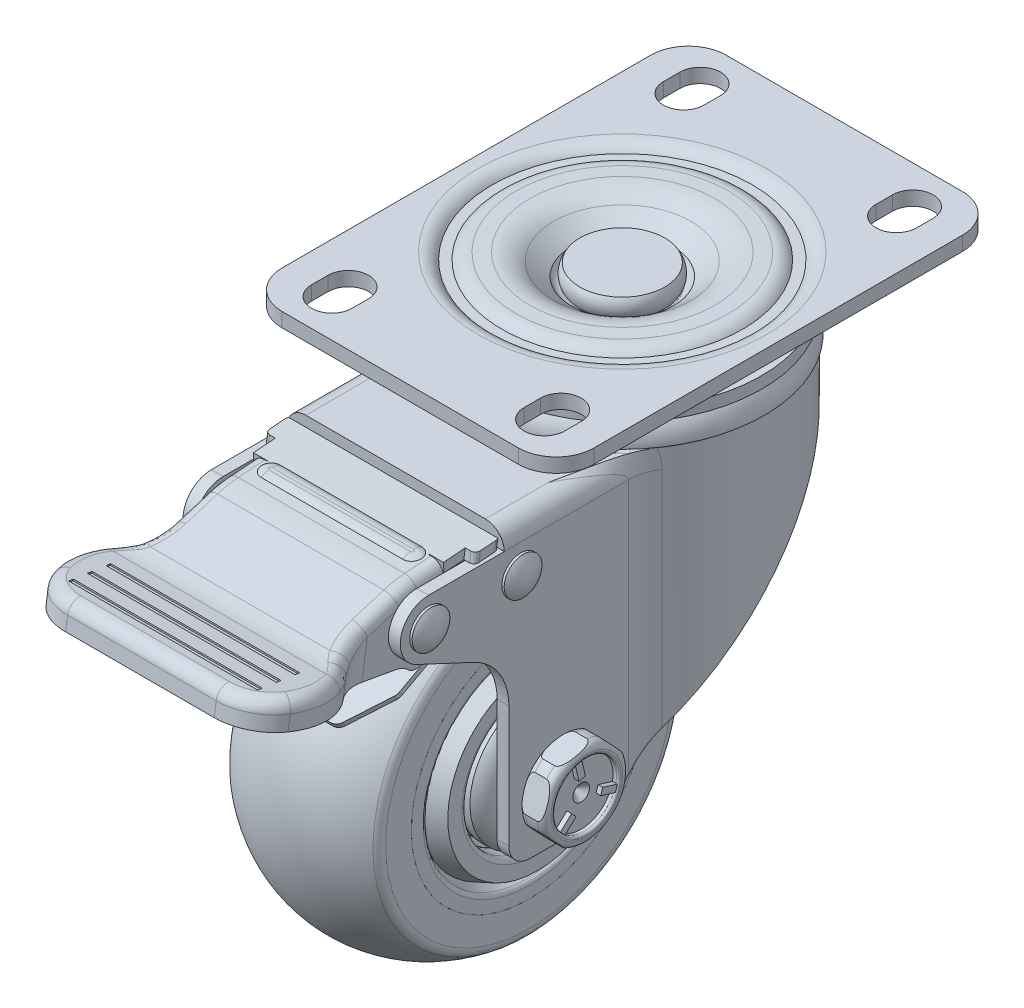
SolidWorks part; units mm, degrees
ref_plane "前视基准面" through (0, 0, 0) normal (0, 0, 1) x (1, 0, 0)
ref_plane "上视基准面" through (0, 0, 0) normal (0, 1, 0) x (1, 0, 0)
ref_plane "右视基准面" through (0, 0, 0) normal (1, 0, 0) x (0, 0, -1)
imported_body "轴承6001_默认-1-solid1"
imported_body "轴承6001_默认-1-solid2"
imported_body "轴承6001_默认-1-solid3"
imported_body "轴承6001_默认-1-solid4"
imported_body "轴承6001_默认-1-solid5"
imported_body "轴承6001_默认-1-solid6"
imported_body "轴承6001_默认-1-solid7"
imported_body "轴承6001_默认-1-solid8"
imported_body "轴承6001_默认-1-solid9"
imported_body "轴承6001_默认-1-solid10"
imported_body "BF30款6mm钢球_默认-1-solid1"
imported_body "BF30款6mm钢球_默认-1-solid2"
imported_body "BF30款6mm钢球_默认-1-solid3"
imported_body "BF30款6mm钢球_默认-1-solid4"
imported_body "BF30款6mm钢球_默认-1-solid5"
imported_body "BF30款6mm钢球_默认-1-solid6"
imported_body "BF30款6mm钢球_默认-1-solid7"
imported_body "BF30款6mm钢球_默认-1-solid8"
imported_body "BF30款6mm钢球_默认-1-solid9"
imported_body "BF30款6mm钢球_默认-1-solid10"
imported_body "BF30款6mm钢球_默认-1-solid11"
imported_body "BF30款6mm钢球_默认-1-solid12"
imported_body "BF30款6mm钢球_默认-1-solid13"
imported_body "BF30款6mm钢球_默认-1-solid14"
imported_body "BF30款6mm钢球_默认-1-solid15"
imported_body "BF30款6mm钢球_默认-1-solid16"
imported_body "BF30款6mm钢球_默认-1-solid17"
imported_body "BF30款6mm钢球_默认-1-solid18"
imported_body "BF30款6mm钢球_默认-1-solid19"
imported_body "BF30款6mm钢球_默认-1-solid20"
imported_body "BF30款6mm钢球_默认-1-solid21"
imported_body "BF30款5mm钢球_默认-1-solid1"
imported_body "BF30款5mm钢球_默认-1-solid2"
imported_body "BF30款5mm钢球_默认-1-solid3"
imported_body "BF30款5mm钢球_默认-1-solid4"
imported_body "BF30款5mm钢球_默认-1-solid5"
imported_body "BF30款5mm钢球_默认-1-solid6"
imported_body "BF30款5mm钢球_默认-1-solid7"
imported_body "BF30款5mm钢球_默认-1-solid8"
imported_body "BF30款5mm钢球_默认-1-solid9"
imported_body "BF30款5mm钢球_默认-1-solid10"
imported_body "BF30款5mm钢球_默认-1-solid11"
imported_body "BF30款5mm钢球_默认-1-solid12"
imported_body "BF30款5mm钢球_默认-1-solid13"
imported_body "BF30款5mm钢球_默认-1-solid14"
imported_body "BF30款5mm钢球_默认-1-solid15"
imported_body "BF30款5mm钢球_默认-1-solid16"
imported_body "BF30款5mm钢球_默认-1-solid17"
imported_body "BF30款5mm钢球_默认-1-solid18"
imported_body "BF30款5mm钢球_默认-1-solid19"
imported_body "BF30款5mm钢球_默认-1-solid20"
imported_body "BF30款5mm钢球_默认-1-solid21"
imported_body "BF30款5mm钢球_默认-1-solid22"
imported_body "BF30款5mm钢球_默认-1-solid23"
imported_body "BF30款5mm钢球_默认-1-solid24"
imported_body "4×49铆钉_默认-1-solid1"
imported_body "轴承6001_默认-2-solid1"
imported_body "轴承6001_默认-2-solid2"
imported_body "轴承6001_默认-2-solid3"
imported_body "轴承6001_默认-2-solid4"
imported_body "轴承6001_默认-2-solid5"
imported_body "轴承6001_默认-2-solid6"
imported_body "轴承6001_默认-2-solid7"
imported_body "轴承6001_默认-2-solid8"
imported_body "轴承6001_默认-2-solid9"
imported_body "轴承6001_默认-2-solid10"
imported_body "3寸半孤平边外包_默认-1-solid1"
imported_body "M10-55螺杆-1-solid1"
imported_body "M10螺母-1-solid1"
imported_body "3寸双轴内芯_默认-1-solid1"
imported_body "BF30款小波碗_默认-1-solid1"
imported_body "BF30款底板_默认-1-solid1"
imported_body "双轴盖仔_默认-1-solid1"
imported_body "3寸刹车片_默认-1-solid1"
imported_body "BF30款防尘圈_默认-1-solid1"
imported_body "40.2mm中型中管_默认-1-solid1"
imported_body "3寸刹车支架_默认-1-solid1"
imported_body "BF30款12×19平头钉_默认-1-solid1"
imported_body "BF30款大波碗_默认-1-solid1"
imported_body "双轴盖仔_默认-2-solid1"
imported_body "4×49铆钉_默认-2-solid1"
imported_body "BF30款刹车齿盘_默认-1-solid1"
imported_body "BF30款铁手柄_默认-1-solid1"
sketch "草图1" plane through (29.4528, 0, 0) normal (1, 0, 0) x (0, 0, -1)
  line L1 (-39.3233, -48.4235) -> (-27.6045, -48.4235)
  line L2 (-39.3233, -48.4235) -> (-39.3233, -71.8611)
  line L3 (-39.3233, -71.8611) -> (-27.6045, -71.8611)
  line L4 (-27.6045, -48.4235) -> (-27.6045, -71.8611)
extrude "凸台-拉伸1" add sketch "草图1" against normal blind 1
sketch "草图2" plane through (22.8028, 0, 0) normal (1, 0, 0) x (0, 0, -1)
  circle A0 centre (-36, -81.8495) radius 30.4248
  circle A1 centre (-36, -81.8495) radius 25
extrude "切除-拉伸1" cut sketch "草图2" along normal up to surface (0.35 mm away)
